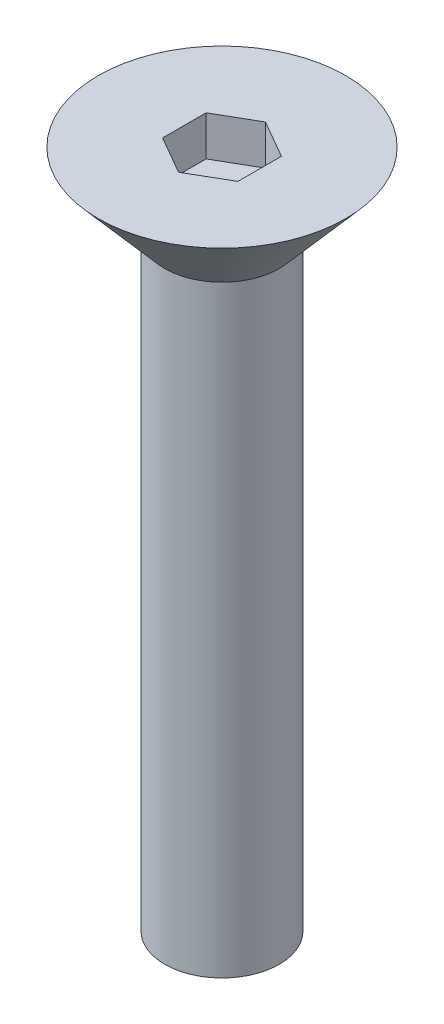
SolidWorks part; units mm, degrees
ref_plane "Plane1" through (0, 0, 0) normal (0, 0, 1) x (1, 0, 0)
ref_plane "Plane2" through (0, 0, 0) normal (0, 1, 0) x (1, 0, 0)
ref_plane "Plane3" through (0, 0, 0) normal (1, 0, 0) x (0, 0, -1)
sketch "Sketch1" plane through (0, 0, 0) normal (0, 0, 1) x (1, 0, 0)
  line L0 (0, 0) -> (5.2197, 0)
  line L1 (2.413, -3.2287) -> (5.2197, 0)
  line L4 (2.413, -3.2287) -> (2.413, -28.6287)
  line L5 (0, 25.4) -> (0, -50.8) construction
  line L6 (2.413, -28.6287) -> (0, -28.6287)
  line L7 (0, 0) -> (0, -28.6287)
  dimension "HeadAngle" = 41
  dimension "HeadWidth" = 10.4394
  dimension "NominalDia" = 4.826
  dimension "ShankLength" = 25.4
revolve "Screw" add sketch "Sketch1" angle 360 about L5
sketch "Sketch2" plane through (0, 0, 0) normal (0, 1, 0) x (-1, 0, 0)
  line L0 (0, -5.08) -> (0, 5.08) construction
  line L1 (18.0975, 0) -> (-21.2725, 0) construction
  line L2 (-1.5875, -0.9165) -> (-1.5875, 0.9165)
  line L3 (0, 1.8331) -> (-1.5875, 0.9165)
  line L4 (0, 1.8331) -> (1.5875, 0.9165)
  line L5 (1.5875, -0.9165) -> (1.5875, 0.9165)
  line L6 (0, -1.8331) -> (-1.5875, -0.9165)
  line L7 (0, -1.8331) -> (1.5875, -0.9165)
  point P8 (-1.5875, 0)
  dimension "D1" = 120
  dimension "HexWidth" = 3.175
extrude "HexCut" cut sketch "Sketch2" against normal blind 1.684
equation "\"HexDepth@HexCut\" =  ( \"HeadWidth@Sketch1\" - \"NominalDia@Sketch1\" )  *  .3"
